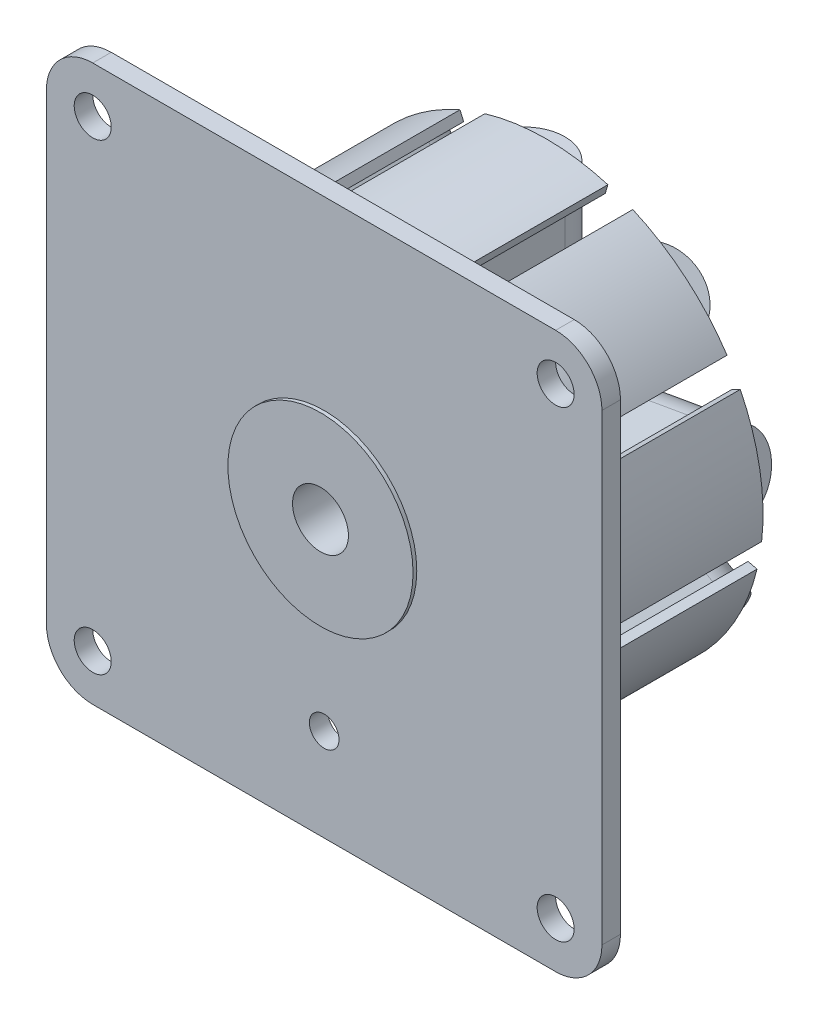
SolidWorks part; units mm, degrees
ref_plane "Plan de face" through (0, 0, 0) normal (0, 0, 1) x (1, 0, 0)
ref_plane "Plan de dessus" through (0, 0, 0) normal (0, 1, 0) x (1, 0, 0)
ref_plane "Plan de droite" through (0, 0, 0) normal (1, 0, 0) x (0, 0, -1)
sketch "Esquisse1" plane through (0, 0, 0) normal (0, 0, 1) x (1, 0, 0)
  circle A0 centre (0, 0) radius 1.51
  circle A1 centre (0, 0) radius 6.25
extrude "Extrusion1" add sketch "Esquisse1" against normal blind 12
sketch "Esquisse2" plane through (0, 0, 0) normal (0, 0, 1) x (1, 0, 0)
  line L1 (-12.5, 15) -> (12.5, 15)
  line L2 (-15, 12.5) -> (-15, -12.5)
  line L3 (-12.5, -15) -> (12.5, -15)
  line L4 (15, 12.5) -> (15, -12.5)
  arc A0 (-12.5, 15) -> (-15, 12.5) centre (-12.5, 12.5) ccw
  arc A1 (12.5, 15) -> (15, 12.5) centre (12.5, 12.5) cw
  arc A2 (12.5, -15) -> (15, -12.5) centre (12.5, -12.5) ccw
  arc A3 (-15, -12.5) -> (-12.5, -15) centre (-12.5, -12.5) ccw
  circle A7 centre (12.5, 12.5) radius 1
  circle A8 centre (-12.5, 12.5) radius 1
  circle A9 centre (-12.5, -12.5) radius 1
  circle A10 centre (12.5, -12.5) radius 1
  dimension "D1" = 2.5
extrude "Extrusion2" add sketch "Esquisse2" against normal blind 1
sketch "Esquisse3" plane through (0, 0, 0) normal (0, 0, 1) x (1, 0, 0)
  circle A0 centre (0, 0) radius 5
extrude "Extrusion3" add sketch "Esquisse3" along normal blind 0.2
sketch "Esquisse4" plane through (0, 0, 0.2) normal (0, 0, 1) x (1, 0, 0)
  circle A0 centre (0, 0) radius 1.51
extrude "Enlèv. mat.-Extru.1" cut sketch "Esquisse4" against normal through all
ref_plane "Plan1" through (0, 5.5, 0) normal (0, 1, 0) x (-1, 0, 0)
sketch "Esquisse5" plane through (0, 5.5, 0) normal (0, 1, 0) x (-1, 0, 0)
  line L1 (-0.01, -2) -> (0.01, -2)
  line L2 (-8.3529, -2) -> (9.1577, -2) construction
  line L3 (-7.1596, -13) -> (7.0764, -13) construction
  line L4 (-2.2, -1.5154) -> (-2.2, -14.3362) construction
  line L5 (2.2, -1.5154) -> (2.2, -14.3362) construction
  line L6 (-2.2, -4.19) -> (-2.2, -10.81)
  line L7 (-0.01, -13) -> (0.01, -13)
  line L8 (2.2, -4.19) -> (2.2, -10.81)
  arc A0 (-0.01, -2) -> (-2.2, -4.19) centre (-0.01, -4.19) ccw
  arc A1 (0.01, -2) -> (2.2, -4.19) centre (0.01, -4.19) cw
  arc A2 (0.01, -13) -> (2.2, -10.81) centre (0.01, -10.81) ccw
  arc A3 (-2.2, -10.81) -> (-0.01, -13) centre (-0.01, -10.81) ccw
  point P15 (-2.2, -2)
  point P17 (-2.2, -2)
  point P18 (-2.2, -2)
  point P22 (2.2, -13)
  point P23 (2.2, -13)
  point P24 (2.2, -13)
  dimension "D1" = 2.19
extrude "Extrusion4" add sketch "Esquisse5" along normal blind 5.8
pattern_circular "Répétition circulaire1" count 9 every 40 about axis through (0, 0, 0) along (0, 0, 1) of "Extrusion4"
sketch "Esquisse6" plane through (0, 0, -12) normal (0, 0, -1) x (-1, 0, 0)
  line L0 (-3.1798, 10.7391) -> (-3.3218, 11.2185)
  line L1 (0, 0) -> (0, 3.9341) construction
  line L2 (3.1798, 10.7391) -> (3.3218, 11.2185)
  arc A0 (3.3218, 11.2185) -> (-3.3218, 11.2185) centre (0, 0) ccw
  arc A1 (3.1798, 10.7391) -> (-3.1798, 10.7391) centre (0, 0) ccw
extrude "Extrusion5" add sketch "Esquisse6" against normal blind 9
pattern_circular "Répétition circulaire2" count 9 every 40 about axis through (0, 0, 0) along (0, 0, 1) of "Extrusion5"
sketch "Esquisse7" plane through (0, 0, 0) normal (0, 0, 1) x (1, 0, 0)
  circle A0 centre (0, -10) radius 0.8
extrude "Enlèv. mat.-Extru.2" cut sketch "Esquisse7" against normal blind 1.5
sketch "Esquisse8" plane through (0, 0, 0) normal (0, 0, 1) x (1, 0, 0)
  text T0 "www.a4.fr" font "Arial" height 0.01
extrude "Enlèv. mat.-Extru.3" cut sketch "Esquisse8" against normal blind 0.01
